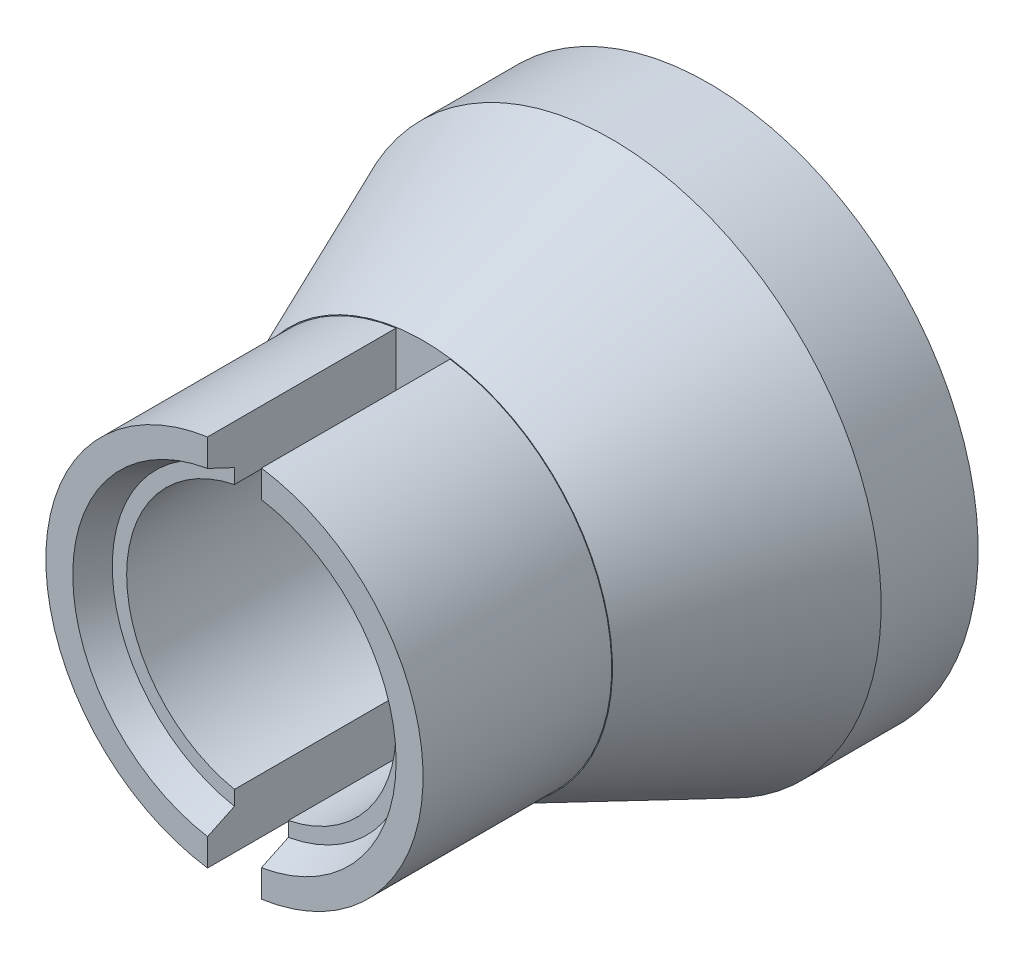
SolidWorks part; units mm, degrees
ref_plane "Plan de face" through (0, 0, 0) normal (0, 0, 1) x (1, 0, 0)
ref_plane "Plan de dessus" through (0, 0, 0) normal (0, 1, 0) x (1, 0, 0)
ref_plane "Plan de droite" through (0, 0, 0) normal (1, 0, 0) x (0, 0, -1)
sketch "Esquisse1" plane through (0, 0, 0) normal (0, 0, 1) x (1, 0, 0)
  line L0 (55, 0) -> (-55, 0) construction
  circle A0 centre (0, 0) radius 2.5
  circle A1 centre (0, 0) radius 3.5
  dimension "D1" = 5
  dimension "D2" = 7
extrude "Extrusion1" add sketch "Esquisse1" along normal blind 3.5
sketch "Esquisse2" plane through (0, 0, 3.5) normal (0, 0, 1) x (1, 0, 0)
  circle A0 centre (0, 0) radius 3
  dimension "D1" = 6
extrude "Enlèv. mat.-Extru.1" cut sketch "Esquisse2" against normal blind 0.5
draft "Dépouille2" type of draft neutral plane draft angle 25 faces to draft 1 parameters "D1"=25
sketch "Esquisse3" plane through (0, 0, 3.5) normal (0, 0, 1) x (1, 0, 0)
  line L0 (0, -4.0485) -> (0, 3.881) construction
  line L2 (-0.5, 3.6855) -> (0.5, 3.6855)
  line L3 (-0.5, 3.6855) -> (-0.5, -3.7693)
  line L4 (-0.5, -3.7693) -> (0.5, -3.7693)
  line L5 (0.5, 3.6855) -> (0.5, -3.7693)
  dimension "D1" = 1
extrude "Enlèv. mat.-Extru.2" cut sketch "Esquisse3" against normal blind 4
sketch "Esquisse4" plane through (0, 0, 0) normal (0, 0, -1) x (-1, 0, 0)
  circle A0 centre (0, 0) radius 5
  dimension "D1" = 10
extrude "Extrusion3" add sketch "Esquisse4" along normal blind 3.5
draft "Dépouille5" type of draft neutral plane draft angle 23 faces to draft 1 parameters "D1"=23
sketch "Esquisse5" plane through (0, 0, -3.5) normal (0, 0, -1) x (-1, 0, 0)
  circle A0 centre (0, 0) radius 5
  circle A1 centre (0, 0) radius 5 construction
extrude "Extrusion4" add sketch "Esquisse5" along normal blind 1.8
sketch "Esquisse6" plane through (0, 0, -5.3) normal (0, 0, -1) x (-1, 0, 0)
  circle A0 centre (0, 0) radius 4.25
  dimension "D1" = 8.5
extrude "Enlèv. mat.-Extru.3" cut sketch "Esquisse6" against normal blind 3.5
sketch "Esquisse7" plane through (0, 0, 0) normal (0, 0, 1) x (1, 0, 0)
  circle A0 centre (0, 0) radius 2.5
extrude "Enlèv. mat.-Extru.4" cut sketch "Esquisse7" against normal through all
draft "Dépouille8" type of draft neutral plane draft angle 27 faces to draft 1 parameters "D1"=27
